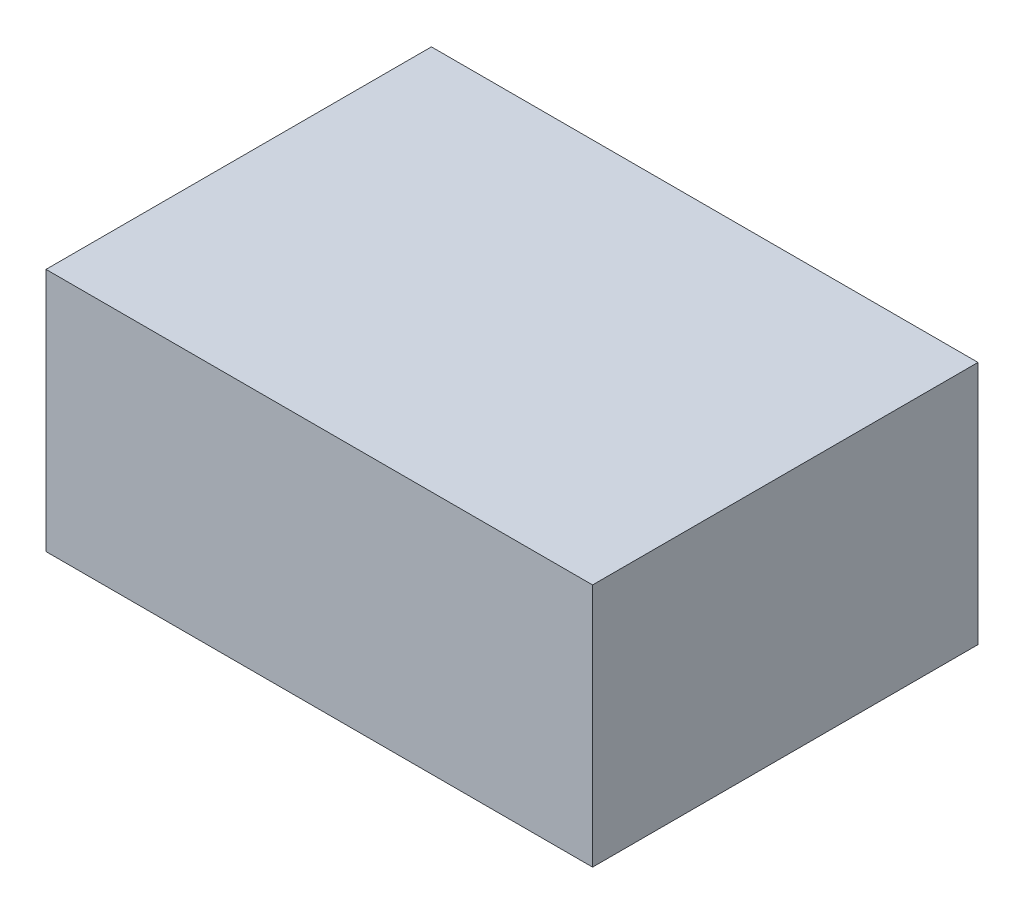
SolidWorks part; units mm, degrees
ref_plane "Front Plane" through (0, 0, 0) normal (0, 0, 1) x (1, 0, 0)
ref_plane "Top Plane" through (0, 0, 0) normal (0, 1, 0) x (1, 0, 0)
ref_plane "Right Plane" through (0, 0, 0) normal (1, 0, 0) x (0, 0, -1)
sketch "Sketch1" plane through (0, 0, 0) normal (0, 1, 0) x (1, 0, 0)
  line L1 (-51.689, -36.449) -> (51.689, -36.449)
  line L2 (-51.689, -36.449) -> (-51.689, 36.449)
  line L3 (-51.689, 36.449) -> (51.689, 36.449)
  line L4 (51.689, -36.449) -> (51.689, 36.449)
  line L5 (-51.689, -36.449) -> (51.689, 36.449) construction
  line L6 (-51.689, 36.449) -> (51.689, -36.449) construction
  point P0 (0, 0)
  dimension "D1" = 103.378
  dimension "D2" = 72.898
extrude "Extrude1" add sketch "Sketch1" along normal blind 46.228
